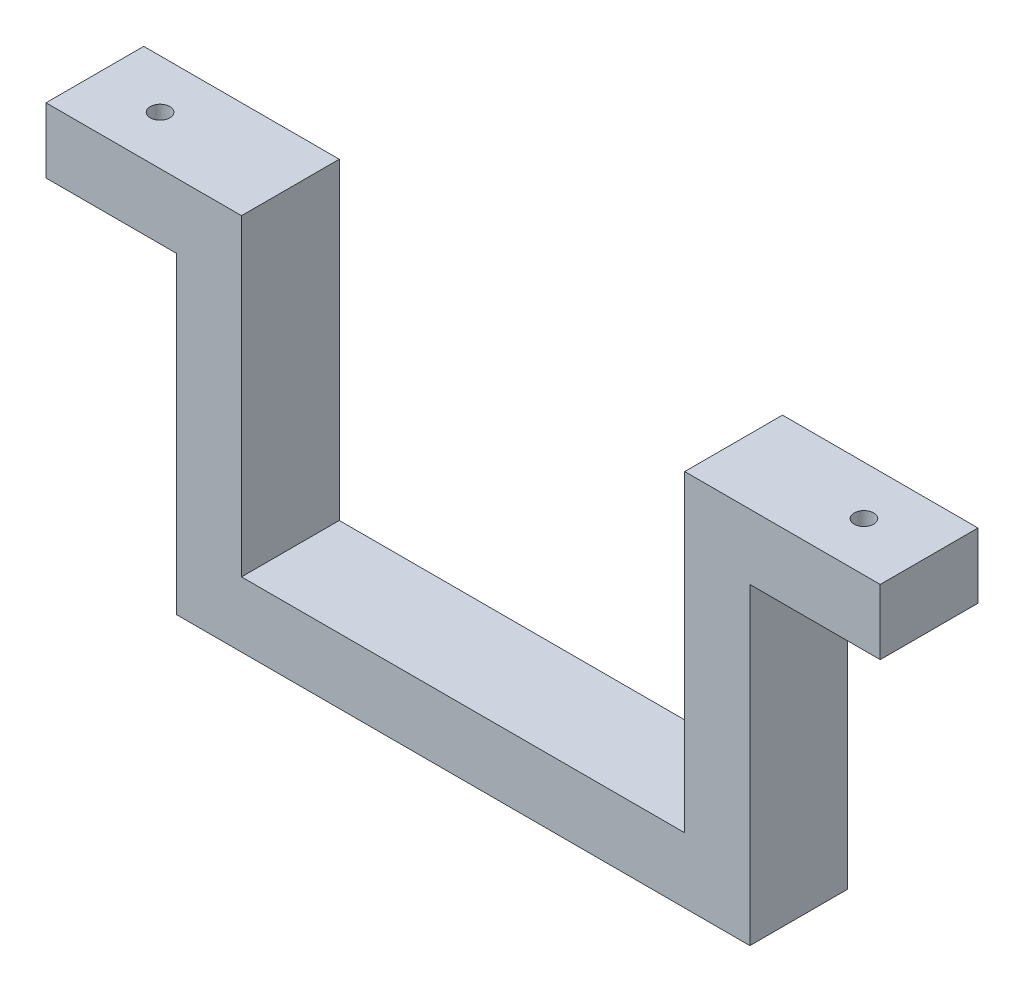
SolidWorks part; units mm, degrees
ref_plane "Plan de face" through (0, 0, 0) normal (0, 0, 1) x (1, 0, 0)
ref_plane "Plan de dessus" through (0, 0, 0) normal (0, 1, 0) x (1, 0, 0)
ref_plane "Plan de droite" through (0, 0, 0) normal (1, 0, 0) x (0, 0, -1)
sketch "Esquisse1" plane through (0, 0, 0) normal (0, 0, 1) x (1, 0, 0)
  line L0 (0, 0) -> (88, 0)
  line L1 (88, 0) -> (88, 48)
  line L2 (88, 48) -> (108, 48)
  line L3 (108, 48) -> (108, 58)
  line L4 (108, 58) -> (78, 58)
  line L5 (78, 58) -> (78, 10)
  line L6 (78, 10) -> (10, 10)
  line L7 (10, 10) -> (10, 58)
  line L8 (10, 58) -> (-20, 58)
  line L9 (-20, 58) -> (-20, 48)
  line L10 (-20, 48) -> (0, 48)
  line L11 (0, 48) -> (0, 0)
  dimension "D1" = 68
  dimension "D2" = 48
  dimension "D3" = 10
  dimension "D4" = 48
  dimension "D5" = 10
  dimension "D6" = 10
  dimension "D7" = 20
  dimension "D8" = 10
  dimension "D9" = 10
  dimension "D10" = 20
extrude "Boss.-Extru.1" add sketch "Esquisse1" along normal blind 15
sketch "Esquisse2" plane through (0, 48, 0) normal (0, -1, 0) x (1, 0, 0)
  line L0 (88, 15) -> (108, 15) construction
  line L1 (108, 15) -> (108, 0) construction
  circle A0 centre (98, 7.5) radius 1.5
  dimension "D1" = 3
  dimension "D2" = 7.5
  dimension "D3" = 10
extrude "Enlèv. mat.-Extru.1" cut sketch "Esquisse2" against normal through all
chamfer "Chanfrein1" distance 3 angle 45 1 edges at (98, 48, 6)
sketch "Esquisse3" plane through (0, 48, 0) normal (0, -1, 0) x (1, 0, 0)
  line L0 (-20, 15) -> (-20, 0) construction
  line L1 (-20, 0) -> (0, 0) construction
  circle A0 centre (-10, 7.5) radius 1.5
  dimension "D1" = 3
  dimension "D2" = 10
  dimension "D3" = 7.5
extrude "Enlèv. mat.-Extru.2" cut sketch "Esquisse3" against normal through all
chamfer "Chanfrein2" distance 3 angle 45 1 edges at (-10, 48, 6)
